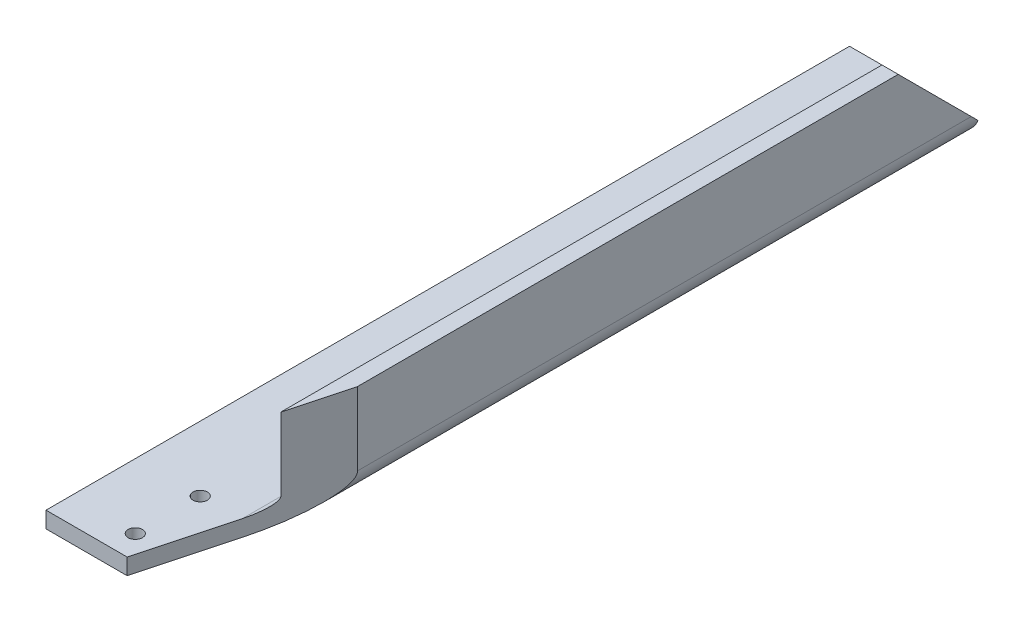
SolidWorks part; units mm, degrees
ref_plane "Plane1" through (0, 0, 0) normal (0, 0, 1) x (1, 0, 0)
ref_plane "Plane2" through (0, 0, 0) normal (0, 1, 0) x (1, 0, 0)
ref_plane "Plane3" through (0, 0, 0) normal (1, 0, 0) x (0, 0, -1)
sketch "Sketch1" plane through (0, 0, 0) normal (0, 0, 1) x (1, 0, 0)
  line L7 (-25.4, 0) -> (-25.4, 6.35)
  line L8 (25.4, 38.1) -> (25.4, 9.525)
  line L9 (19.05, 38.1) -> (25.4, 38.1)
  line L10 (19.05, 9.525) -> (19.05, 38.1)
  line L11 (15.875, 6.35) -> (-25.4, 6.35)
  line L12 (15.875, 0) -> (-25.4, 0)
  arc A0 (19.05, 9.525) -> (15.875, 6.35) centre (15.875, 9.525) cw
  arc A1 (25.4, 9.525) -> (15.875, 0) centre (15.875, 9.525) cw
  dimension "D1" = 3.175
  dimension "D2" = 9.525
  dimension "D3" = 50.8
  dimension "D4" = 25.4
  dimension "D5" = 6.35
  dimension "D6" = 38.1
  dimension "D7" = 6.35
extrude "Base-Extrude" add sketch "Sketch1" along normal blind 314.325
sketch "Sketch2" plane through (0, 6.35, 0) normal (0, 1, 0) x (-1, 0, 0)
  line L2 (-6.35, 314.325) -> (-38.1, 314.325)
  line L4 (-38.1, 314.325) -> (-38.1, 195.8324)
  line L5 (-38.1, 195.8324) -> (-6.35, 314.325)
  line L6 (25.4, 314.325) -> (25.4, 0) construction
  line L7 (-15.875, 314.325) -> (25.4, 314.325) construction
  line L8 (-15.875, 0) -> (25.4, 0) construction
  circle A0 centre (6.35, 22.6314) radius 2.286
  circle A1 centre (-6.35, 22.6314) radius 2.286
  circle A2 centre (-6.35, 5.1562) radius 2.286
  circle A3 centre (6.35, 5.1562) radius 2.286
  circle A4 centre (0, 304.8) radius 2.794
  circle A5 centre (0, 279.4) radius 2.794
  dimension "D2" = 6.35
  dimension "D4" = 6.35
  dimension "D5" = 5.1562
  dimension "D6" = 5.1562
  dimension "D7" = 17.4752
  dimension "D8" = 17.4752
  dimension "D9" = 4.572
  dimension "D10" = 25.4
  dimension "D11" = 25.4
  dimension "D12" = 279.4
  dimension "D14" = 5.588
  dimension "D13" = 25.4
  dimension "D1" = 6.35
  dimension "D3" = 6.35
  dimension "D15" = 31.75
  dimension "D17" = 31.75
  dimension "D18" = 75
extrude "Cut-Extrude1" cut sketch "Sketch2" against normal mid plane 76.2
sketch "Sketch4" plane through (0, 0, 0) normal (0, 0, -1) x (-1, 0, 0)
  line L1 (25.4, 6.35) -> (25.4, 0) construction
  line L2 (25.4, 6.35) -> (25.4, 0)
  line L3 (25.4, 0) -> (-15.875, 0) construction
  line L4 (25.4, 0) -> (19.05, 0)
  arc A0 (19.05, 0) -> (25.4, 6.35) centre (19.05, 6.35) ccw
  dimension "D2" = 12.7
  dimension "D1" = 6.35
extrude "Cut-Extrude3" cut sketch "Sketch4" against normal blind 38.1
sketch "Sketch5" plane through (25.4, 0, 0) normal (1, 0, 0) x (0, 0, -1)
  line L0 (0, 6.35) -> (-31.75, 38.1)
  line L1 (-38.1, 6.35) -> (0, 6.35) construction
  line L2 (-243.2294, 38.1) -> (0, 38.1) construction
  line L3 (-31.75, 38.1) -> (0, 38.1)
  line L4 (0, 38.1) -> (0, 6.35)
  dimension "D1" = 45
extrude "Cut-Extrude4" cut sketch "Sketch5" against normal through all
